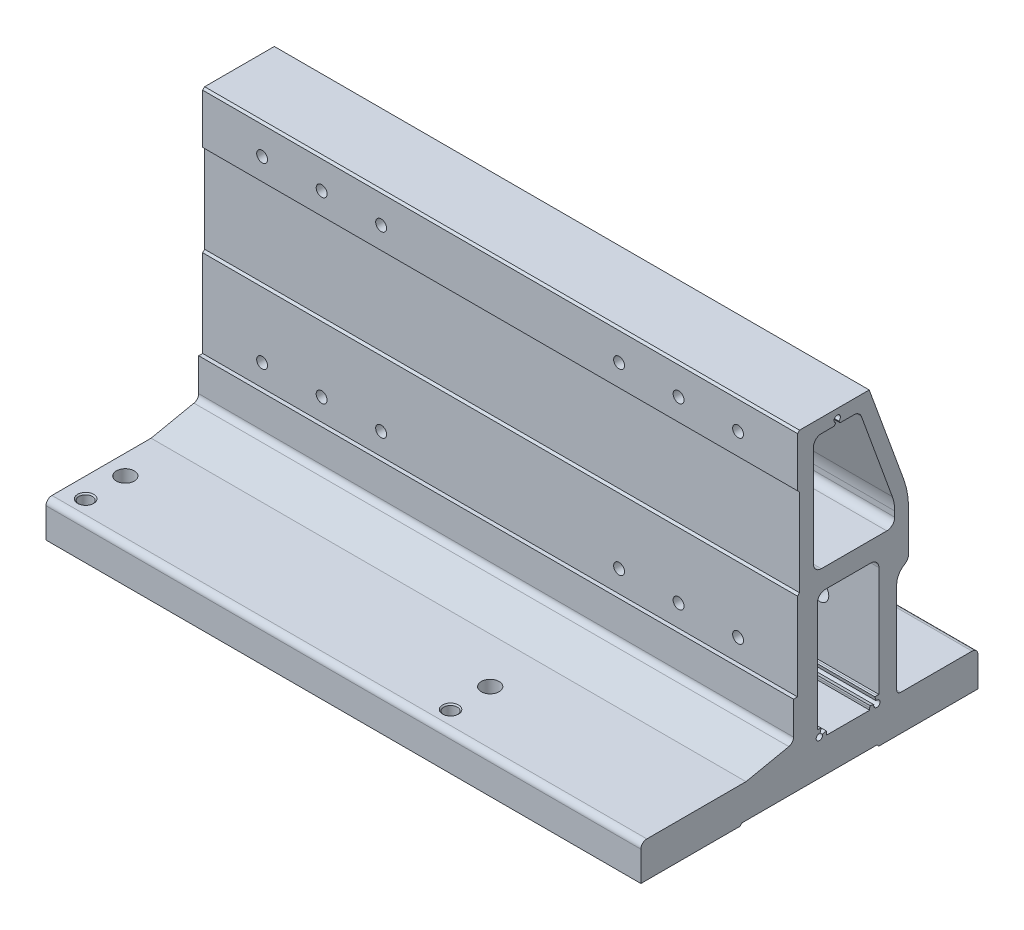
SolidWorks part; units mm, degrees
ref_plane "정면" through (0, 0, 0) normal (0, 0, 1) x (1, 0, 0)
ref_plane "윗면" through (0, 0, 0) normal (0, 1, 0) x (1, 0, 0)
ref_plane "우측면" through (0, 0, 0) normal (1, 0, 0) x (0, 0, -1)
sketch "스케치1" plane through (0, 0, 0) normal (1, 0, 0) x (0, 0, -1)
  line L0 (-6, 131) -> (-5, 130)
  line L1 (-5, 130) -> (-5, 86)
  line L2 (-5, 86) -> (-6, 85)
  line L3 (-6, 85) -> (-6, 40.9998)
  line L4 (-6, 40.9998) -> (-8, 40.9998)
  line L5 (-8, 40.9998) -> (-8, 24.4394)
  line L6 (-10.3881, 21.5025) -> (-32, 17)
  line L7 (-32, 17) -> (-82, 17)
  line L8 (-85, 14) -> (-85, -1)
  line L9 (-85, -1) -> (-35, -1)
  line L10 (-35, -1) -> (-34, 0)
  line L11 (-34, 0) -> (34, 0)
  line L12 (34, 0) -> (35, -1)
  line L13 (35, -1) -> (85, -1)
  line L14 (85, -1) -> (85, 14)
  line L15 (82, 17) -> (46, 17)
  line L16 (44, 19) -> (44, 65)
  line L17 (50, 75.3923) -> (50, 95.442)
  line L18 (47.5845, 109.1317) -> (30.149, 157)
  line L19 (30.149, 157) -> (-5, 157)
  line L20 (-5, 157) -> (-6, 156)
  line L21 (-6, 156) -> (-6, 131)
  line L22 (2, 95) -> (2, 146)
  line L23 (6, 150) -> (12.5566, 150)
  line L24 (12.5566, 150) -> (13.2, 151.1144)
  line L25 (14.8, 151.1144) -> (15.4434, 150)
  line L26 (15.4434, 150) -> (22.4487, 150)
  line L27 (26.2071, 147.369) -> (41.7922, 104.5807)
  line L28 (43, 97.7359) -> (43, 95)
  line L29 (39, 91) -> (6, 91)
  line L30 (8, 81) -> (31, 81)
  line L31 (35, 77) -> (35, 21.6)
  line L32 (35, 21.6) -> (34, 21.6)
  line L33 (33.0683, 21.4773) -> (33.5859, 19.5455)
  line L34 (32.4545, 18.4141) -> (30.5227, 18.9317)
  line L35 (30.4, 18) -> (30.4, 17)
  line L36 (30.4, 17) -> (8.6, 17)
  line L37 (8.6, 17) -> (8.6, 18)
  line L38 (8.4773, 18.9317) -> (6.5455, 18.4141)
  line L39 (5.4141, 19.5455) -> (5.9317, 21.4773)
  line L40 (5, 21.6) -> (4, 21.6)
  line L41 (4, 21.6) -> (4, 77)
  arc A0 (-10.3881, 21.5025) -> (-8, 24.4394) centre (-11, 24.4394) ccw
  arc A1 (-82, 17) -> (-85, 14) centre (-82, 14) ccw
  arc A2 (85, 14) -> (82, 17) centre (82, 14) ccw
  arc A3 (44, 19) -> (46, 17) centre (46, 19) ccw
  arc A4 (48, 71.9282) -> (44, 65) centre (52, 65) ccw
  arc A5 (48, 71.9282) -> (50, 75.3923) centre (46, 75.3923) ccw
  arc A6 (50, 95.442) -> (47.5845, 109.1317) centre (10, 95.442) ccw
  arc A7 (6, 150) -> (2, 146) centre (6, 146) ccw
  arc A8 (14.8, 151.1144) -> (13.2, 151.1144) centre (14, 152.5) ccw
  arc A9 (26.2071, 147.369) -> (22.4487, 150) centre (22.4487, 146) ccw
  arc A10 (43, 97.7359) -> (41.7922, 104.5807) centre (23, 97.7359) ccw
  arc A11 (39, 91) -> (43, 95) centre (39, 95) ccw
  arc A12 (2, 95) -> (6, 91) centre (6, 95) ccw
  arc A13 (8, 81) -> (4, 77) centre (8, 77) ccw
  arc A14 (35, 77) -> (31, 81) centre (31, 77) ccw
  arc A15 (34, 21.6) -> (33.0683, 21.4773) centre (34, 18) ccw
  arc A16 (32.4545, 18.4141) -> (33.5859, 19.5455) centre (34, 18) ccw
  arc A17 (30.5227, 18.9317) -> (30.4, 18) centre (34, 18) ccw
  arc A18 (8.6, 18) -> (8.4773, 18.9317) centre (5, 18) ccw
  arc A19 (5.4141, 19.5455) -> (6.5455, 18.4141) centre (5, 18) ccw
  arc A20 (5.9317, 21.4773) -> (5, 21.6) centre (5, 18) ccw
extrude "보스-돌출1" add sketch "스케치1" along normal mid plane 300
hole_wizard "M5 소켓 머리 캡 나사용 카운터보어1" positions "스케치2" profile "스케치3" counterbore size "M5" standard "KS"
sketch "스케치2" plane through (0, 0, -50) normal (0, 0, -1) x (-1, 0, 0)
  line L0 (-150, 109.1317) -> (-150, 157) construction
  line L1 (-150, -1) -> (150, -1) construction
  point P0 (-120, 142)
  point P2 (-90, 142)
  point P4 (-60, 142)
  point P6 (-120, 52)
  point P8 (-90, 52)
  point P10 (-60, 52)
  dimension "D1" = 30
  dimension "D2" = 30
  dimension "D3" = 30
  dimension "D4" = 90
  dimension "D5" = 53
sketch "스케치3" plane through (120, 142, -50) normal (1, 0, 0) x (0, 1, 0)
  line L0 (0, 0) -> (0, 135)
  line L1 (0, 135) -> (2.75, 135)
  line L3 (2.75, 135) -> (2.75, 49)
  line L4 (2.75, 49) -> (4.75, 49)
  line L5 (4.75, 49) -> (4.75, 0)
  line L7 (4.75, 0) -> (0, 0)
  line L11 (0, -6.35) -> (0, 107.95) construction
  dimension "관통 구멍 지름" = 5.5
  dimension "관통 구멍 깊이" = 135
  dimension "카운터보어 지름" = 9.5
  dimension "카운터보어 깊이" = 49
pattern_linear "선형 패턴1" count 2 spacing 180 along (-1, 0, 0) of "M5 소켓 머리 캡 나사용 카운터보어1"
hole_wizard "M5 나사 구멍1" positions "스케치4" profile "스케치5" tap size "M5" standard "ISO"
sketch "스케치4" plane through (-150, 0, 0) normal (-1, 0, 0) x (0, 0, 1)
  line L0 (-85, -1) -> (-85, 14) construction
  line L1 (-35, -1) -> (-85, -1) construction
  point P0 (-45, 8)
  point P2 (-9, 8)
  dimension "D1" = 40
  dimension "D2" = 36
  dimension "D3" = 9
sketch "스케치5" plane through (-150, 8, -45) normal (0, 1, 0) x (0, 0, 1)
  line L0 (0, 0) -> (0, 13.2618)
  line L1 (0, 13.2618) -> (2.1, 12)
  line L2 (2.1, 12) -> (2.1, 0.425)
  line L3 (2.1, 0.425) -> (2.525, 0)
  line L5 (2.525, 0) -> (0, 0)
  line L6 (-2.1, 0.425) -> (-2.525, 0) construction
  line L10 (0, 13.2618) -> (-2.1, 12) construction
  line L11 (0, -6.35) -> (0, 107.95) construction
  dimension "탭 드릴 지름" = 4.2
  dimension "탭 드릴 깊이" = 12
  dimension "표면 카운터싱크 지름" = 5.05
  dimension "표면 카운터싱크 각도" = 90
  dimension "드릴 각도" = 118
hole_wizard "M8 나사 구멍1" positions "스케치6" profile "스케치7" tap size "M8" standard "ISO"
sketch "스케치6" plane through (0, -1, 0) normal (0, -1, 0) x (-1, 0, 0)
  line L0 (-150, 85) -> (150, 85) construction
  line L1 (150, -85) -> (150, -35) construction
  point P0 (140, -75)
  point P2 (-44, -75)
  point P4 (140, 75)
  point P6 (-44, 75)
  dimension "D1" = 10
  dimension "D2" = 150
  dimension "D3" = 10
  dimension "D4" = 184
sketch "스케치7" plane through (-140, -1, 75) normal (1, 0, 0) x (0, 0, -1)
  line L0 (0, 0) -> (0, 18)
  line L1 (0, 18) -> (4.025, 18)
  line L2 (3.4, 17.375) -> (3.4, 0.625)
  line L3 (3.4, 0.625) -> (4.025, 0)
  line L5 (4.025, 0) -> (0, 0)
  line L6 (-3.4, 0.625) -> (-4.025, 0) construction
  line L7 (4.025, 18) -> (3.4, 17.375)
  line L8 (-4.025, 18) -> (-3.4, 17.375) construction
  line L11 (0, -6.35) -> (0, 107.95) construction
  dimension "관통 탭 드릴 지름" = 6.8
  dimension "관통 탭 드릴 깊이" = 18
  dimension "표면 카운터싱크 지름" = 8.05
  dimension "표면 카운터싱크 각도" = 90
  dimension "안쪽면 카운터싱크 지름" = 8.05
  dimension "안쪽면 카운터싱크 각도" = 90
hole_wizard "Ø6.0mm 맞춤핀 구멍1" positions "스케치8" profile "스케치9" hole size "Ø6.0" standard "ISO"
sketch "스케치8" plane through (0, 0, 0) normal (0, -1, 0) x (-1, 0, 0)
  line L0 (0, 0) -> (163.6006, 0) construction
  line L1 (150, -34) -> (150, 34) construction
  point P5 (140, 0)
  point P7 (-44, 0)
  dimension "D1" = 184
  dimension "D2" = 10
sketch "스케치9" plane through (44, 0, 0) normal (1, 0, 0) x (0, 0, -1)
  line L0 (0, 0) -> (0, 11.8026)
  line L1 (0, 11.8026) -> (3, 10)
  line L2 (3, 10) -> (3, 0)
  line L5 (3, 0) -> (0, 0)
  line L10 (0, 11.8026) -> (-3, 10) construction
  line L11 (0, -6.35) -> (0, 107.95) construction
  dimension "구멍 지름" = 6
  dimension "구멍 깊이" = 10
  dimension "드릴 각도" = 118
hole_wizard "Ø9.0 (9) 지름 구멍1" positions "스케치10" profile "스케치11" hole size "Ø9.0" standard "ISO"
sketch "스케치10" plane through (0, -1, 0) normal (0, -1, 0) x (-1, 0, 0)
  line L0 (150, -85) -> (150, -35) construction
  line L1 (-150, 85) -> (150, 85) construction
  point P0 (140, -55)
  point P2 (-44, -55)
  point P4 (140, 55)
  point P6 (-44, 55)
  dimension "D1" = 184
  dimension "D2" = 10
  dimension "D3" = 30
  dimension "D4" = 110
sketch "스케치11" plane through (-140, -1, 55) normal (1, 0, 0) x (0, 0, -1)
  line L0 (0, 0) -> (0, 158)
  line L1 (0, 158) -> (4.5, 158)
  line L2 (4.5, 158) -> (4.5, 0)
  line L5 (4.5, 0) -> (0, 0)
  line L11 (0, -6.35) -> (0, 107.95) construction
  dimension "관통 구멍 지름" = 9
  dimension "관통 구멍 깊이" = 158
